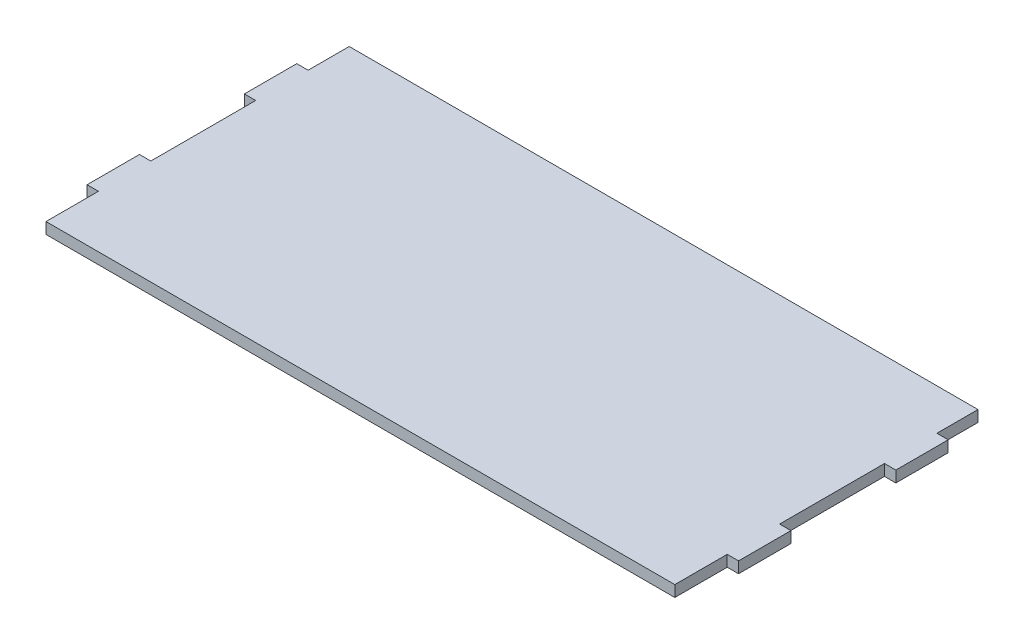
SolidWorks part; units mm, degrees
ref_plane "Front Plane" through (0, 0, 0) normal (0, 0, 1) x (1, 0, 0)
ref_plane "Top Plane" through (0, 0, 0) normal (0, 1, 0) x (1, 0, 0)
ref_plane "Right Plane" through (0, 0, 0) normal (1, 0, 0) x (0, 0, -1)
sketch "Sketch1" plane through (0, 0, 0) normal (0, 1, 0) x (1, 0, 0)
  line L0 (0.3326, 305.8068) -> (-16.1451, 305.8068)
  line L1 (0.3326, 365.5548) -> (914.7326, 365.5548)
  line L2 (0.3326, 365.5548) -> (0.3326, 305.8068)
  line L3 (0.3326, -75.3452) -> (914.7326, -75.3452)
  line L4 (0.3326, 77.0721) -> (0.3326, 229.6068)
  line L5 (-16.1451, 305.8068) -> (-16.1451, 229.6068)
  line L6 (-16.1451, 229.6068) -> (0.3326, 229.6068)
  line L7 (0.3326, 0.8721) -> (-16.1495, 0.8721)
  line L8 (-16.1495, 0.8721) -> (-16.1495, 77.0721)
  line L9 (-16.1495, 77.0721) -> (0.3326, 77.0721)
  line L11 (931.2104, 229.6068) -> (914.7326, 229.6068)
  line L12 (931.2104, 305.8068) -> (931.2104, 229.6068)
  line L13 (914.7326, 305.8068) -> (931.2104, 305.8068)
  line L14 (931.2148, 77.0721) -> (914.7326, 77.0721)
  line L15 (914.7326, 0.8721) -> (931.2148, 0.8721)
  line L16 (931.2148, 0.8721) -> (931.2148, 77.0721)
  line L17 (0.3326, 0.8721) -> (0.3326, -75.3452)
  line L18 (914.7326, 365.5548) -> (914.7326, 305.8068)
  line L19 (914.7326, 229.6068) -> (914.7326, 77.0721)
  line L20 (914.7326, 0.8721) -> (914.7326, -75.3452)
extrude "Boss-Extrude1" add sketch "Sketch1" along normal blind 16.3
equation "\"Thikness\"= 0.6417323"
